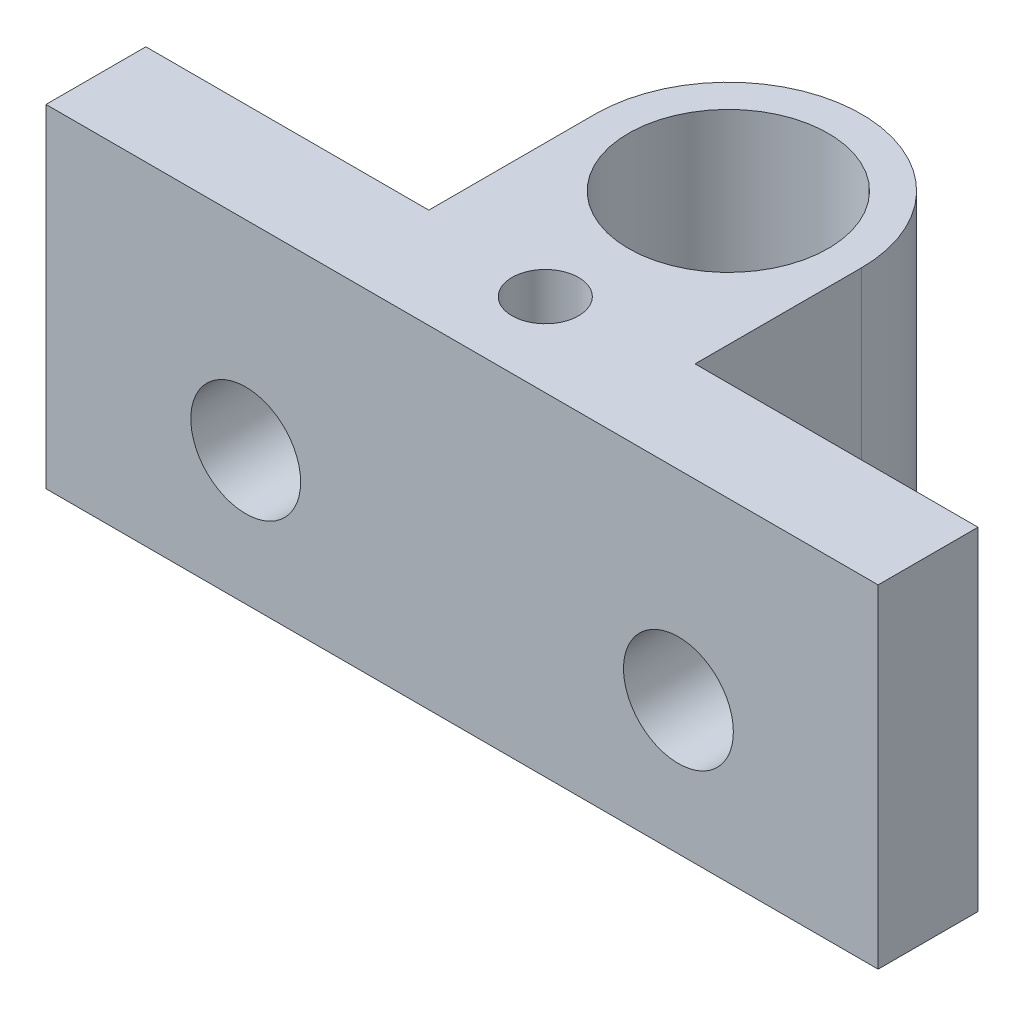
SolidWorks part; units mm, degrees
ref_plane "Front" through (0, 0, 0) normal (0, 0, 1) x (1, 0, 0)
ref_plane "Top" through (0, 0, 0) normal (0, 1, 0) x (1, 0, 0)
ref_plane "Right" through (0, 0, 0) normal (1, 0, 0) x (0, 0, -1)
sketch "草图2" plane through (0, 0, 0) normal (0, 1, 0) x (1, 0, 0)
  line L0 (8.5, 8) -> (8.5, 3)
  line L1 (0, 0) -> (25, 0)
  line L2 (0, 0) -> (0, 3)
  line L3 (0, 3) -> (25, 3)
  line L4 (25, 0) -> (25, 3)
  line L5 (16.5, 8) -> (16.5, 3)
  circle A0 centre (12.5, 8) radius 4
  circle A1 centre (12.5, 8) radius 3
  dimension "D2" = 8
  dimension "D6" = 6
  dimension "D1" = 3
  dimension "D3" = 5
  dimension "D4" = 25
  dimension "D5" = 12.5
extrude "凸台-拉伸1" add sketch "草图2" along normal blind 10 contours A0 A1 | A0 L3 L5 | A0 L0 L3 | L1 L4 L3 L2
hole_wizard "Ø3.3 (3.3) 直径孔1" positions "草图3" profile "草图4" hole size "Ø3.3" standard "GB"
sketch "草图3" plane through (0, 0, 0) normal (0, 0, 1) x (1, 0, 0)
  point P0 (6, 4)
  point P3 (19, 4)
sketch "草图4" plane through (6, 4, 0) normal (1, 0, 0) x (0, -1, 0)
  line L0 (0, 0) -> (0, 12)
  line L1 (0, 12) -> (1.65, 12)
  line L2 (1.65, 12) -> (1.65, 0)
  line L5 (1.65, 0) -> (0, 0)
  line L11 (0, -6.35) -> (0, 107.95) construction
  dimension "通孔孔直径" = 3.3
  dimension "通孔孔深度" = 12
sketch "草图5" plane through (0, 10, 0) normal (0, 1, 0) x (1, 0, 0)
  line L0 (0, 0) -> (25, 0) construction
  circle A0 centre (12.5, 2.5) radius 1
  circle A1 centre (12.5, 8) radius 3 construction
  dimension "D1" = 0
  dimension "D3" = 2
  dimension "D2" = 2.5
extrude "切除-拉伸1" cut sketch "草图5" against normal up to next
